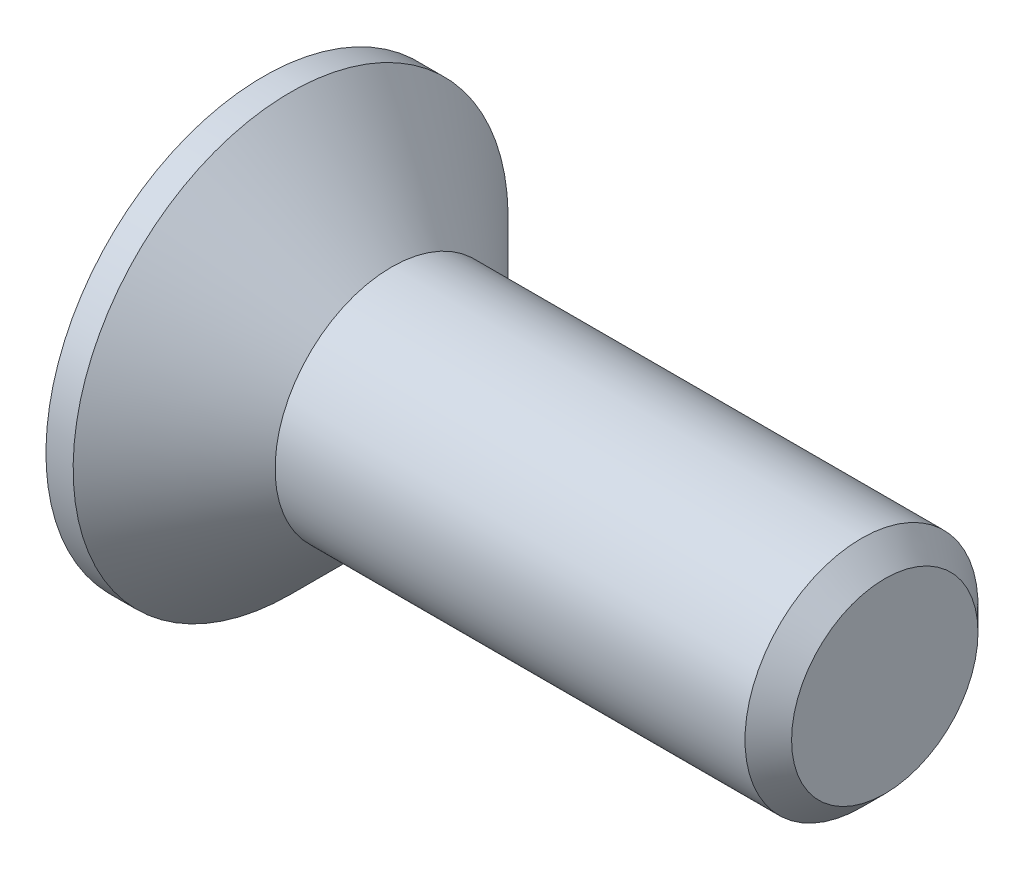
SolidWorks part; units mm, degrees
ref_plane "Front Plane" through (0, 0, 0) normal (0, 0, 1) x (1, 0, 0)
ref_plane "Top Plane" through (0, 0, 0) normal (0, 1, 0) x (1, 0, 0)
ref_plane "Right Plane" through (0, 0, 0) normal (1, 0, 0) x (0, 0, -1)
sketch "Sketch1" plane through (0, 0, 0) normal (0, 0, 1) x (1, 0, 0)
  line L1 (-1.65, 2.8) -> (-1.65, 0)
  line L2 (-1.65, 0) -> (6.35, 0)
  line L3 (6.35, 0) -> (6.35, 1.5)
  line L4 (6.35, 1.5) -> (0, 1.5)
  line L5 (-1.65, 2.8) -> (-1.3, 2.8)
  line L6 (-1.3, 2.8) -> (0, 1.5)
  dimension "D1" = 1.5
  dimension "D2" = 45
  dimension "D3" = 1.65
  dimension "D4" = 8
  dimension "D5" = 2.8
revolve "Revolve1" add sketch "Sketch1" angle 360 about L2
chamfer "Chamfer1" distance 0.3 angle 45 1 edges at (6.35, -1.5, 0)
sketch "Sketch2" plane through (-1.65, 0, 0) normal (-1, 0, 0) x (0, 0, 1)
  line L0 (-0.365, 1.45) -> (0.365, 1.45)
  line L1 (0.365, 1.45) -> (0.365, 0.365)
  line L2 (0.365, 0.365) -> (1.45, 0.365)
  line L3 (1.45, 0.365) -> (1.45, -0.365)
  line L4 (1.45, -0.365) -> (0.365, -0.365)
  line L5 (0.365, -0.365) -> (0.365, -1.45)
  line L6 (0.365, -1.45) -> (-0.365, -1.45)
  line L7 (-0.365, -1.45) -> (-0.365, -0.365)
  line L8 (-0.365, -0.365) -> (-1.45, -0.365)
  line L9 (-1.45, -0.365) -> (-1.45, 0.365)
  line L10 (-1.45, 0.365) -> (-0.365, 0.365)
  line L11 (-0.365, 0.365) -> (-0.365, 1.45)
  point P2 (0, 1.45)
  point P14 (0, -1.45)
  point P15 (1.45, 0)
  point P16 (-1.45, 0)
  dimension "D1" = 2.9
  dimension "D2" = 0.73
extrude "Cut-Extrude1" cut sketch "Sketch2" against normal blind 1.25
